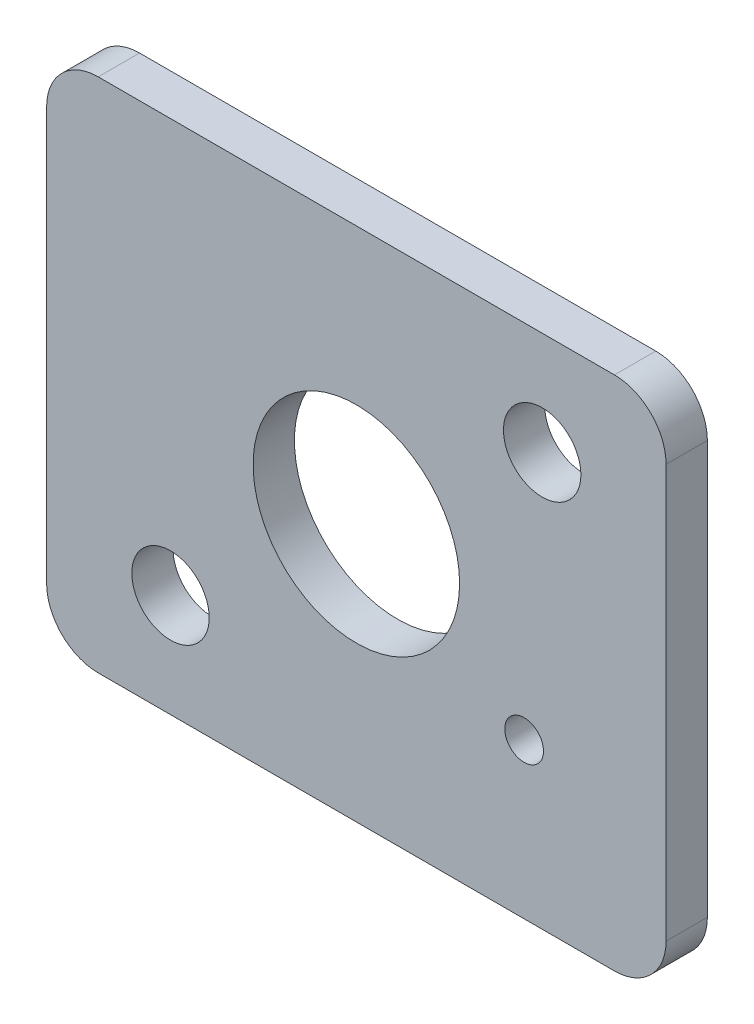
SolidWorks part; units mm, degrees
ref_plane "Спереди" through (0, 0, 0) normal (0, 0, 1) x (1, 0, 0)
ref_plane "Сверху" through (0, 0, 0) normal (0, 1, 0) x (1, 0, 0)
ref_plane "Справа" through (0, 0, 0) normal (1, 0, 0) x (0, 0, -1)
sketch "Эскиз1" plane through (0, 0, 0) normal (0, 0, 1) x (1, 0, 0)
  line L1 (-6, -5) -> (6, -5)
  line L2 (-6, -5) -> (-6, 5)
  line L3 (-6, 5) -> (6, 5)
  line L4 (6, -5) -> (6, 5)
  line L5 (-6, -5) -> (6, 5) construction
  line L6 (-6, 5) -> (6, -5) construction
  point P0 (0, 0)
  dimension "D1" = 12
  dimension "D2" = 10
extrude "Бобышка-Вытянуть1" add sketch "Эскиз1" along normal blind 0.8
sketch "Эскиз2" plane through (0, 0, 0.8) normal (0, 0, 1) x (1, 0, 0)
  line L0 (-6, -5) -> (6, 5) construction
  line L1 (-6, -5) -> (6, -5) construction
  line L4 (6, 5) -> (-6, 5) construction
  line L5 (6, -5) -> (6, 5) construction
  circle A0 centre (0, 0) radius 2
  circle A1 centre (-3.6, -3) radius 0.75
  circle A2 centre (3.6, 3) radius 0.75
  circle A3 centre (3.25, -2) radius 0.375
  dimension "D1" = 4
  dimension "D3" = 1.5
  dimension "D5" = 1.5
  dimension "D8" = 0.75
  dimension "D2" = 2
  dimension "D4" = 2
  dimension "D6" = 2.75
  dimension "D7" = 3
extrude "Вырез-Вытянуть1" cut sketch "Эскиз2" against normal up to next
fillet "Скругление1" radius 1 4 edges at (6, -5, 0.4) (-6, -5, 0.4) (-6, 5, 0.4) (6, 5, 0.4)
